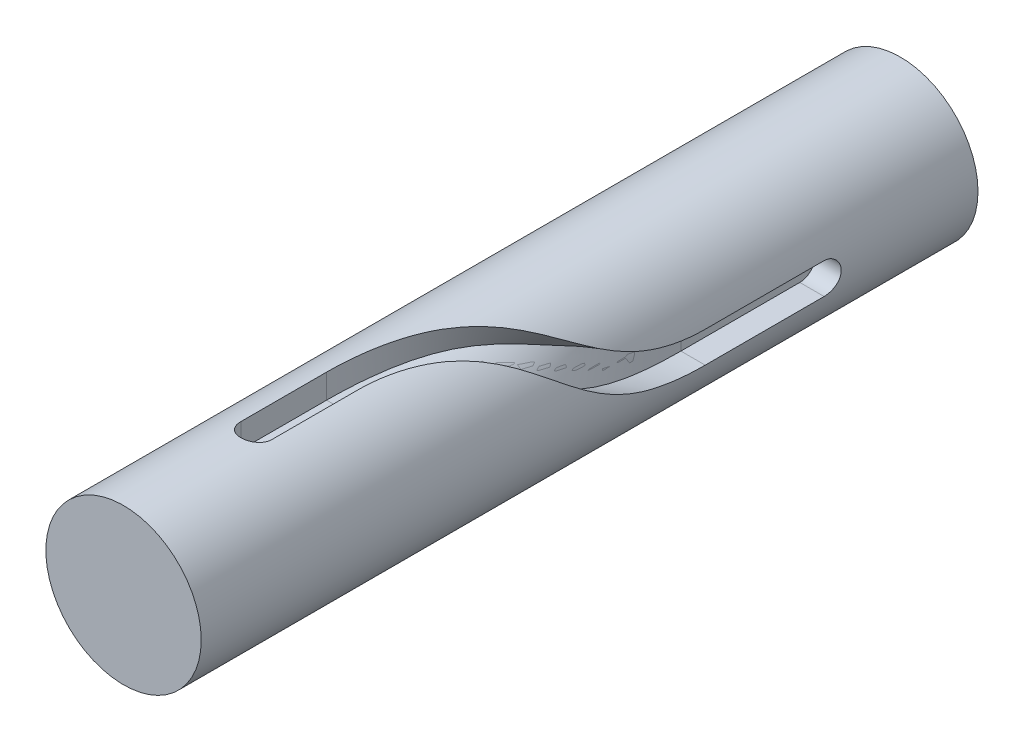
SolidWorks part; units mm, degrees
ref_plane "Vorderseite" through (0, 0, 0) normal (0, 0, 1) x (1, 0, 0)
ref_plane "oben" through (0, 0, 0) normal (0, 1, 0) x (-1, 0, 0)
ref_plane "rechts" through (0, 0, 0) normal (1, 0, 0) x (0, 0, -1)
sketch "Skizze1" plane through (0, 0, 0) normal (0, 1, 0) x (-1, 0, 0)
  line L0 (0, 92.5137) -> (0, -83.9344) construction
  line L1 (0, 75) -> (-15, 75)
  line L2 (0, 75) -> (0, -75)
  line L3 (0, -75) -> (-15, -75)
  line L4 (-15, 75) -> (-15, -75)
  dimension "D1" = 30
  dimension "D2" = 150
revolve "Rotation1" add sketch "Skizze1" angle 360 about L0
sketch "Skizze2" plane through (0, 0, 0) normal (0, 1, 0) x (-1, 0, 0)
  line L0 (0, 49.3407) -> (0, 32.7834)
surface "Oberfläche-Linear austragen1" sketch "Skizze2" parameters "D1"=30
sketch "Skizze3" plane through (0, 0, 0) normal (1, 0, 0) x (0, 0, -1)
  line L0 (22.6283, 0) -> (45.5877, 0)
surface "Oberfläche-Linear austragen2" sketch "Skizze3" parameters "D1"=30
surface "Oberfläche-Ausformung1"
surface "Oberfläche-Zusammenfügen1"
sketch "Skizze4" plane through (0, 0, 0) normal (0, 0, 1) x (1, 0, 0)
  circle A0 centre (0, 0) radius 10
  dimension "D1" = 20
surface "Oberfläche-Linear austragen5" sketch "Skizze4" parameters "D1"=110
surface "Oberfläche-Trimmen1"
thicken "Schnitt-Wanddicke auftragen1" surfaces to thicken 112 thickness 3 thickness side both sides parameters "D1"=3
sketch "Skizze5" plane through (0, 10, 0) normal (0, 1, 0) x (-1, 0, 0)
  line L0 (3, 49.3407) -> (-3, 49.3407) construction
  line L1 (3, 32.7834) -> (3, 49.3407) construction
  circle A0 centre (0, 49.3407) radius 3
extrude "Schnitt-Linear austragen1" cut sketch "Skizze5" along normal through all
sketch "Skizze6" plane through (10, 0, 0) normal (1, 0, 0) x (0, 0, -1)
  line L0 (45.5877, 3) -> (45.5877, -3) construction
  circle A0 centre (45.5877, 0) radius 3
extrude "Schnitt-Linear austragen2" cut sketch "Skizze6" along normal through all
